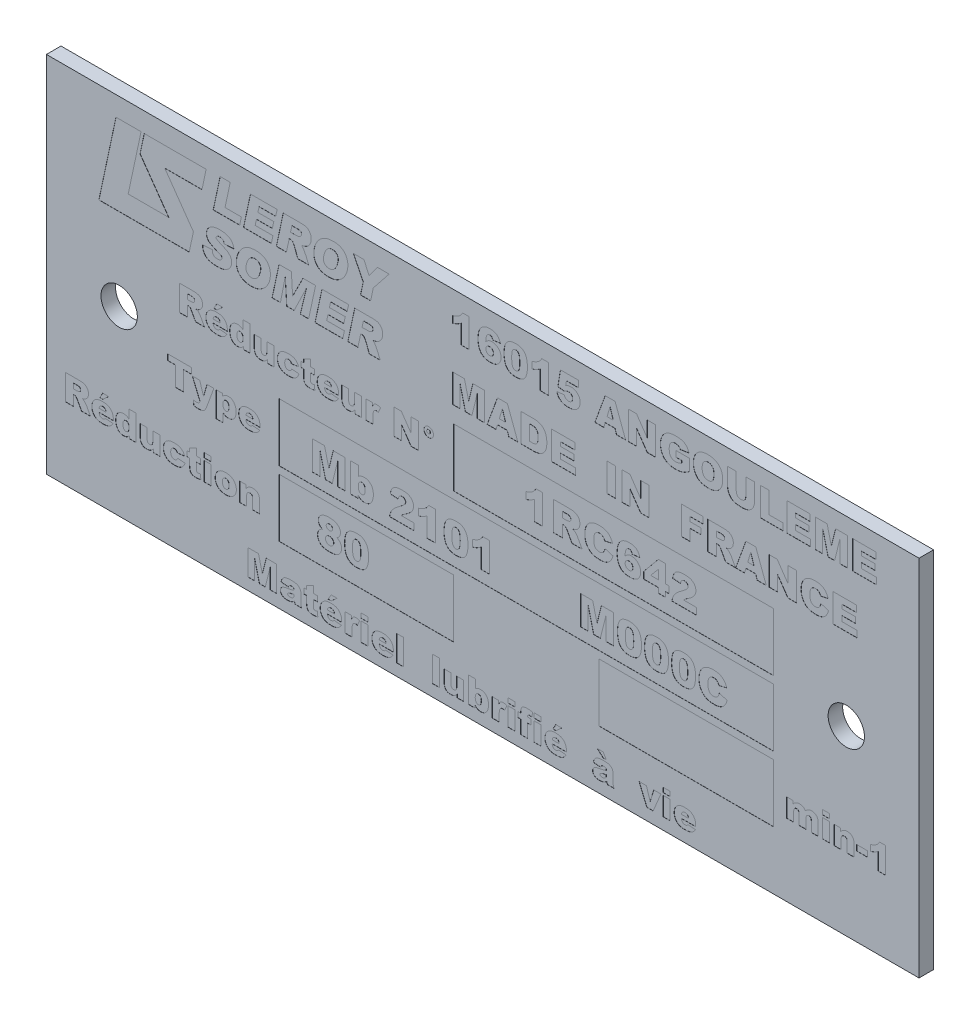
SolidWorks part; units mm, degrees
ref_plane "Face" through (0, 0, 0) normal (0, 0, 1) x (1, 0, 0)
ref_plane "Dessus" through (0, 0, 0) normal (0, 1, 0) x (1, 0, 0)
ref_plane "Droite" through (0, 0, 0) normal (1, 0, 0) x (0, 0, -1)
sketch "Esquisse1" plane through (0, 0, 0) normal (0, 0, 1) x (1, 0, 0)
  line L1 (0, 0) -> (60, 0)
  line L2 (0, 0) -> (0, 25)
  line L3 (0, 25) -> (60, 25)
  line L4 (60, 0) -> (60, 25)
  circle A0 centre (5, 12.5) radius 1.25
  circle A1 centre (55, 12.5) radius 1.25
  dimension "D3" = 2.5
  dimension "D4" = 2.5
  dimension "D5" = 5
  dimension "D6" = 5
  dimension "D7" = 12.5
  dimension "D1" = 60
  dimension "D2" = 25
extrude "Base-Extrusion" add sketch "Esquisse1" along normal blind 1
sketch "Esquisse2" plane through (0, 0, 1) normal (0, 0, 1) x (1, 0, 0)
  text T0 "16015 ANGOULEME  MADE  IN  FRANCE" font "Arial Black" height in points 8
extrude "Enlèv. mat.-Extru.1" cut sketch "Esquisse2" against normal blind 0.01
sketch "Esquisse3" plane through (0, 0, 1) normal (0, 0, 1) x (1, 0, 0)
  line L0 (0, 0) -> (60, 0) construction
  line L1 (28, 17) -> (50, 17)
  line L2 (28, 17) -> (28, 13)
  line L3 (28, 13) -> (50, 13)
  line L4 (50, 17) -> (50, 13)
  line L5 (0, 25) -> (0, 0) construction
  line L6 (16, 8) -> (28, 8)
  line L7 (16, 12.5) -> (50, 12.5)
  line L8 (16, 12.5) -> (16, 8.5)
  line L9 (16, 8.5) -> (50, 8.5)
  line L10 (50, 12.5) -> (50, 8.5)
  line L11 (16, 8) -> (16, 4)
  line L12 (16, 4) -> (28, 4)
  line L13 (28, 8) -> (28, 4)
  line L14 (38, 8) -> (50, 8)
  line L15 (38, 8) -> (38, 4)
  line L16 (38, 4) -> (50, 4)
  line L17 (50, 8) -> (50, 4)
  dimension "D1" = 22
  dimension "D2" = 4
  dimension "D3" = 28
  dimension "D4" = 34
  dimension "D5" = 4
  dimension "D6" = 0.5
  dimension "D7" = 4
  dimension "D8" = 0.5
  dimension "D9" = 4
  dimension "D10" = 12
extrude "Enlèv. mat.-Extru.2" cut sketch "Esquisse3" against normal blind 0.01
sketch "Esquisse4" plane through (0, 0, 1) normal (0, 0, 1) x (1, 0, 0)
  text T0 "Réduction" font "Arial Black" height in points 7
extrude "Enlèv. mat.-Extru.3" cut sketch "Esquisse4" against normal blind 0.01
sketch "Esquisse5" plane through (0, 0, 1) normal (0, 0, 1) x (1, 0, 0)
  text T0 "min-1" font "Arial Black" height in points 7
extrude "Enlèv. mat.-Extru.4" cut sketch "Esquisse5" against normal blind 0.01
sketch "Esquisse6" plane through (0, 0, 1) normal (0, 0, 1) x (1, 0, 0)
  text T0 "Matériel  lubrifié  à  vie" font "Arial Black" height in points 7
extrude "Enlèv. mat.-Extru.5" cut sketch "Esquisse6" against normal blind 0.01
sketch "Esquisse7" plane through (0, 0, 1) normal (0, 0, 1) x (1, 0, 0)
  text T0 "Réducteur N°" font "Arial Black" height in points 7
extrude "Enlèv. mat.-Extru.6" cut sketch "Esquisse7" against normal blind 0.01
sketch "Esquisse8" plane through (0, 0, 1) normal (0, 0, 1) x (1, 0, 0)
  text T0 "Type" font "Arial Black" height in points 7
extrude "Enlèv. mat.-Extru.7" cut sketch "Esquisse8" against normal blind 0.01
sketch "Esquisse9" plane through (0, 0, 1) normal (0, 0, 1) x (1, 0, 0)
  text T0 "LEROY" font "Arial Black" height in points 9
extrude "Enlèv. mat.-Extru.8" cut sketch "Esquisse9" against normal blind 0.01
sketch "Esquisse10" plane through (0, 0, 1) normal (0, 0, 1) x (1, 0, 0)
  text T0 "L" font "Arial Black" height in points 22
extrude "Enlèv. mat.-Extru.9" cut sketch "Esquisse10" against normal blind 0.01
sketch "Esquisse11" plane through (0, 0, 1) normal (0, 0, 1) x (1, 0, 0)
  line L0 (6.7223, 23.6517) -> (10.98, 23.6517)
  line L1 (8.1362, 22.2915) -> (10.6936, 22.2915)
  line L2 (10.6936, 22.2915) -> (10.98, 23.6517)
  line L3 (8.1362, 22.2915) -> (10.1052, 19.4965)
  line L4 (10.1052, 19.4965) -> (9.8186, 18.1353)
  line L5 (9.8186, 18.1353) -> (8.1183, 18.1353)
  line L6 (6.7223, 23.6517) -> (6.4359, 22.2915)
  line L7 (6.4359, 22.2915) -> (8.4049, 19.4965)
  line L8 (8.1183, 18.1353) -> (3.6049, 18.1353) construction
  line L9 (5.621, 19.4965) -> (8.4049, 19.4965) construction
  line L10 (8.4049, 19.4965) -> (8.1183, 18.1353) construction
  line L11 (8.4049, 19.4965) -> (8.1183, 18.1353)
  dimension "D1" = 1.39
  dimension "D2" = 1.39
extrude "Enlèv. mat.-Extru.10" cut sketch "Esquisse11" against normal blind 0.01
sketch "Esquisse12" plane through (0, 0, 1) normal (0, 0, 1) x (1, 0, 0)
  text T0 "SOMER" font "Arial Black" height in points 9
extrude "Enlèv. mat.-Extru.11" cut sketch "Esquisse12" against normal blind 0.01
sketch "Esquisse13" plane through (0, 0, 0.99) normal (0, 0, 1) x (1, 0, 0)
  text T0 "1RC642" font "Arial Black" height in points 8
extrude "Enlèv. mat.-Extru.12" cut sketch "Esquisse13" against normal blind 0.01
sketch "Esquisse14" plane through (0, 0, 0.99) normal (0, 0, 1) x (1, 0, 0)
  text T0 "Mb 2101      M000C" font "Arial Black" height in points 8
extrude "Enlèv. mat.-Extru.13" cut sketch "Esquisse14" against normal blind 0.01
sketch "Esquisse15" plane through (0, 0, 0.99) normal (0, 0, 1) x (1, 0, 0)
  text T0 "80" font "Arial Black" height in points 8
extrude "Enlèv. mat.-Extru.14" cut sketch "Esquisse15" against normal blind 0.01
